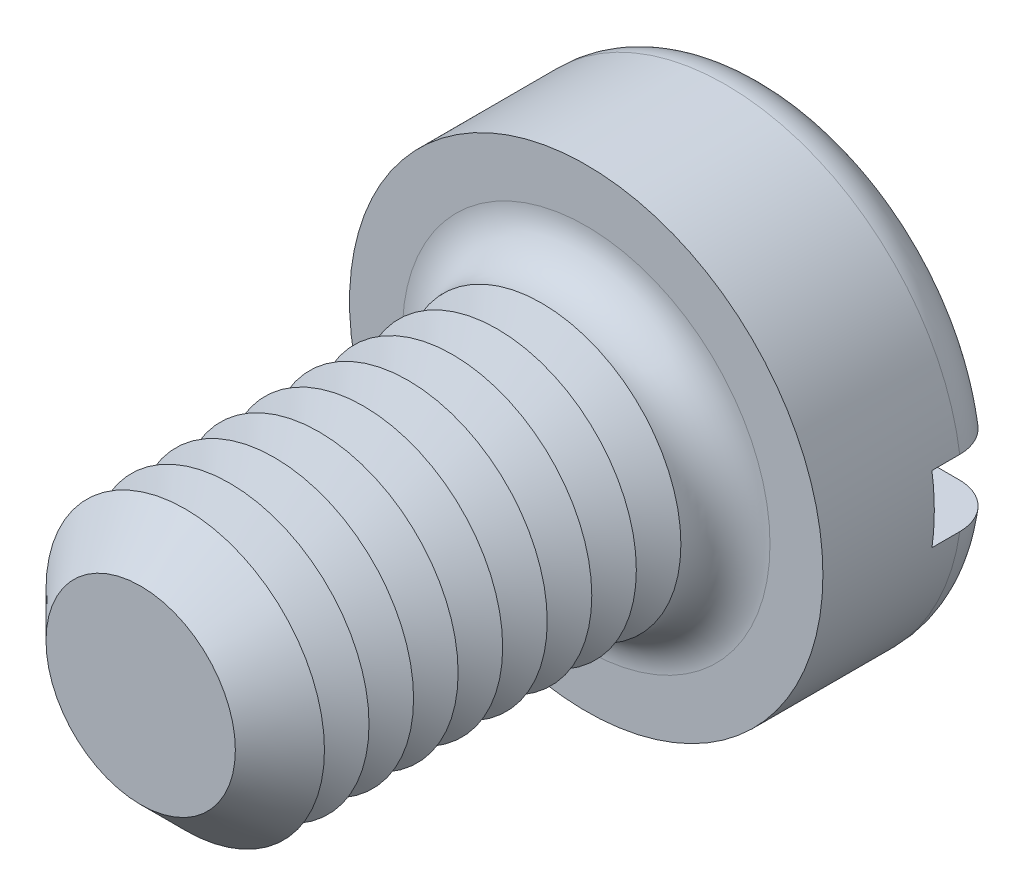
SolidWorks part; units mm, degrees
ref_plane "Front Plane" through (0, 0, 0) normal (0, 0, 1) x (1, 0, 0)
ref_plane "Top Plane" through (0, 0, 0) normal (0, 1, 0) x (1, 0, 0)
ref_plane "Right Plane" through (0, 0, 0) normal (1, 0, 0) x (0, 0, -1)
sketch "Sketch3" plane through (0, 0, 0) normal (0, 0, 1) x (1, 0, 0)
  circle A0 centre (0, 0) radius 4.25
  dimension "D1" = 8.5
extrude "Boss-Extrude2" add sketch "Sketch3" against normal blind 3.3
sketch "Sketch4" plane through (0, 0, 0) normal (0, 0, 1) x (1, 0, 0)
  circle A0 centre (0, 0) radius 2.5
  dimension "D1" = 5
extrude "Boss-Extrude3" add sketch "Sketch4" along normal blind 8
fillet "Fillet1" radius 0.8 2 edges at (4.25, 0, -3.3) (2.5, 0, 0)
chamfer "Chamfer1" distance 0.8 angle 45 1 edges at (2.5, 0, 8)
sketch "Sketch5" plane through (0, 0, 0) normal (1, 0, 0) x (0, 0, -1)
  line L0 (1.6944, 0) -> (-7.6738, 0) construction
sketch "Sketch6" plane through (0, 0, 0) normal (1, 0, 0) x (0, 0, -1)
  line L0 (-0.8, 2.5) -> (-1.2, 1.8072)
  line L1 (-1.2, 1.8072) -> (-1.6, 2.5)
  line L2 (-0.8, 2.5) -> (-7.2, 2.5) construction
  line L3 (-1.6, 2.5) -> (-0.8, 2.5)
  dimension "D1" = 0.8
revolve "Cut-Revolve1" cut sketch "Sketch6" angle 360 about L0
pattern_linear "LPattern1" count 8 spacing 0.8 along (0, 0, 1) of "Cut-Revolve1"
sketch "Sketch8" plane through (0, 0, -3.3) normal (0, 0, -1) x (-1, 0, 0)
  line L1 (4.25, -0.6) -> (-4.25, -0.6)
  line L2 (4.25, -0.6) -> (4.25, 0.6)
  line L3 (4.25, 0.6) -> (-4.25, 0.6)
  line L4 (-4.25, -0.6) -> (-4.25, 0.6)
  line L5 (4.25, -0.6) -> (-4.25, 0.6) construction
  line L6 (4.25, 0.6) -> (-4.25, -0.6) construction
  point P0 (0, 0)
  dimension "D1" = 8.5
  dimension "D2" = 1.2
extrude "Cut-Extrude1" cut sketch "Sketch8" against normal blind 1.3
